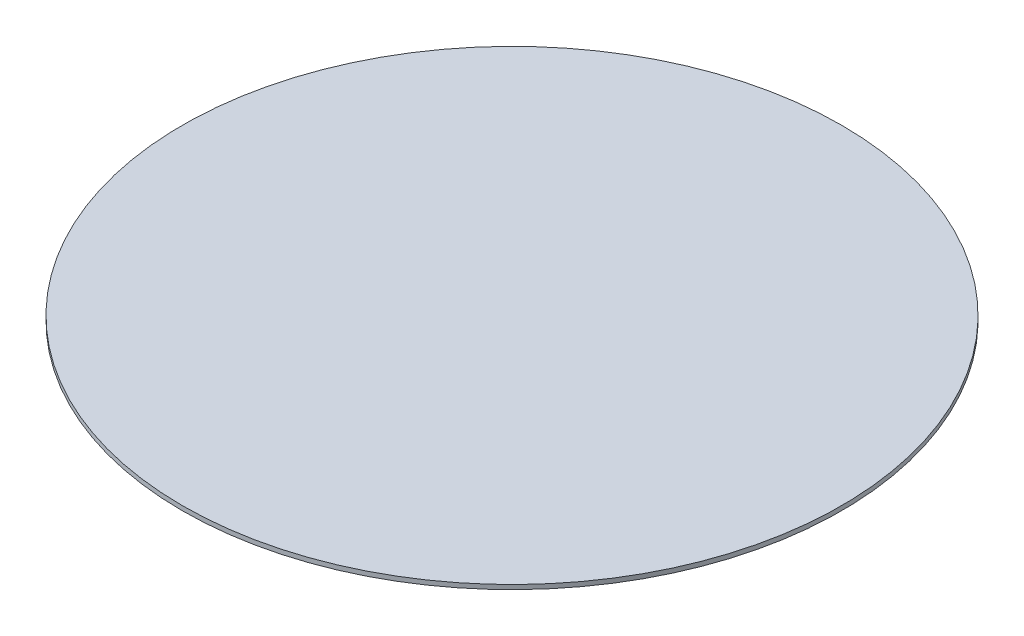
SolidWorks part; units mm, degrees
ref_plane "Front Plane" through (0, 0, 0) normal (0, 0, 1) x (1, 0, 0)
ref_plane "Top Plane" through (0, 0, 0) normal (0, 1, 0) x (1, 0, 0)
ref_plane "Right Plane" through (0, 0, 0) normal (1, 0, 0) x (0, 0, -1)
sketch "Sketch1" plane through (0, 0, 0) normal (0, 1, 0) x (1, 0, 0)
  circle A0 centre (0, 0) radius 187.96
  dimension "D1" = 375.92
extrude "Boss-Extrude1" add sketch "Sketch1" along normal blind 2.54
